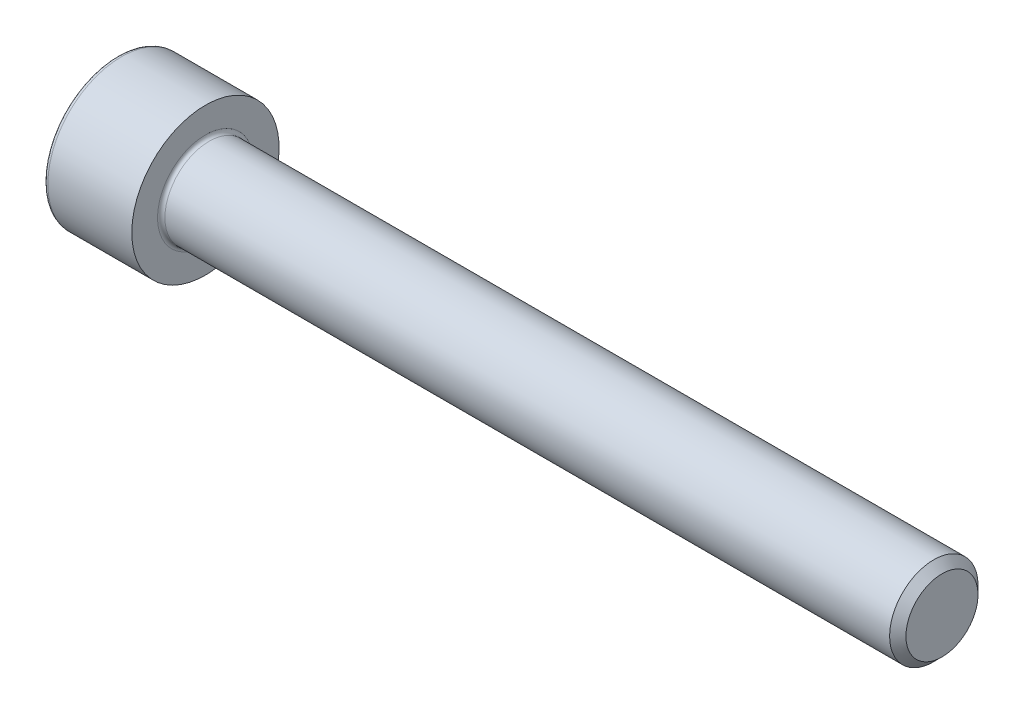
SolidWorks part; units mm, degrees
revolve "Base-Revolve" add sketch "BodySke"
sketch "BodySke" plane through (0, 0, 0) normal (0, 0, 1) x (1, 0, 0)
  line L0 (0, 0) -> (0, 5)
  line L1 (0, 5) -> (6, 5)
  line L2 (6, 5) -> (6, 3)
  line L3 (6, 3) -> (55.4455, 3)
  line L4 (56, 2.4455) -> (56, 0)
  line L5 (56, 0) -> (0, 0)
  line L6 (-31.75, 0) -> (127, 0) construction
  line L8 (56, 2.4455) -> (55.4455, 3)
  line L10 (56, -2.4455) -> (55.4455, -3) construction
  line L11 (7, 9.525) -> (7, 3.175) construction
  line L12 (32, 9.525) -> (32, 3.175) construction
  line L13 (-4, 9.525) -> (-4, 3.175) construction
fillet "Fillet1" radius 0.25 1 edges at (6, 0, 3)
fillet "Fillet2" radius 0.3 1 edges at (0, 0, 5)
ref_plane "Plane1" through (0, 0, 0) normal (0, 0, 1) x (1, 0, 0)
ref_plane "Plane2" through (0, 0, 0) normal (0, 1, 0) x (1, 0, 0)
ref_plane "Plane3" through (0, 0, 0) normal (1, 0, 0) x (0, 0, -1)
other "Configuration Table"
sketch "Sketch2" plane through (0, 0, 0) normal (0, 0, 1) x (1, 0, 0)
  line L0 (0, 2.542) -> (3, 2.542)
  line L1 (3, 2.542) -> (4.4676, 0)
  line L2 (-31.75, 0) -> (127, 0) construction
  line L3 (4.4676, 0) -> (0, 0)
  line L4 (0, 0) -> (0, 2.542)
  line L6 (0, 0) -> (47.625, 0) construction
revolve "Hex-PreBroach" cut sketch "Sketch2" angle 360 about L6
sketch "Sketch3" plane through (0, 0, 0) normal (-1, 0, 0) x (0, 0.5, 0.866)
  line L0 (1.4676, 2.542) -> (-1.4676, 2.542)
  line L1 (-1.4676, 2.542) -> (-2.9352, 0)
  line L2 (1.4676, 2.542) -> (2.9352, 0)
  line L3 (1.4676, -2.542) -> (2.9352, 0)
  line L4 (1.4676, -2.542) -> (-1.4676, -2.542)
  line L5 (-1.4676, -2.542) -> (-2.9352, 0)
extrude "Hex" cut sketch "Sketch3" against normal blind 3
sketch "ThdSchSke" plane through (0, 0, 0) normal (0, 0, 1) x (1, 0, 0)
  line L0 (32, -2.4455) -> (31.6117, -3)
  line L1 (32, -2.4455) -> (32.3883, -3)
  line L2 (32.3883, -3) -> (32.3883, -3.75)
  line L3 (-3.175, 0) -> (5.1513, 0) construction
  line L4 (0, 4.7) -> (0, -4.7) construction
  line L5 (32.3883, -3.75) -> (31.6117, -3.75)
  line L6 (31.6117, -3.75) -> (31.6117, -3)
revolve "ThreadSchematic" [suppressed] cut sketch "ThdSchSke" angle 360 about L3
pattern_linear "ThdSchPat" [suppressed]
equation "\"D2@Sketch3\" = \"Hex_size@Sketch3\" / 2"
equation "\"D1@Sketch3\" = \"Hex_size@Sketch3\" / 2"
equation "\"D1@Sketch2\" = \"Hex_size@Sketch3\" / 2"
equation "\"Thread_minor@ThreadCosmetic\"  =  \"Minor_dia@BodySke\""
equation "\"Depth@Sketch2\" =  \"Key_eng@Hex\""
equation "\"Thread_length@ThreadCosmetic\" = ((sgn( (\"Length@BodySke\" - \"Advance@BodySke\" * 3.0) - \"Thread_nom@BodySke\" )-1)*( (\"Length@BodySke\" - \"Advance@BodySke\" * 3.0) - \"Thread_nom@BodySke\" ))/-2+ \"Thread_no"
equation "\"Thread_minor@ThdSchSke\" = \"Minor_dia@BodySke\""
equation "\"Diameter@ThdSchSke\" = \"Diameter@BodySke\""
equation "\"Overcut@ThdSchSke\" = \"Diameter@BodySke\" * 1.25"
equation "\"Start@ThdSchSke\" = \"Head_ht@BodySke\" + \"Length@BodySke\" - \"Thread_length@ThreadCosmetic\"  '---Non-countersunk---"
equation "\"Num_threads@ThdSchPat\" = int( \"Thread_length@ThreadCosmetic\" / \"Advance@BodySke\" + 0.999 )  + 1"
equation "\"Advance@ThdSchPat\" = \"Thread_length@ThreadCosmetic\" /  (\"Num_threads@ThdSchPat\" - 1) 'relax it"
equation "\"Num_threads@ThdSchPat\" = \"Num_threads@ThdSchPat\" - sgn( \"Num_threads@ThdSchPat\" - 1) '---chamfered tips only---"
